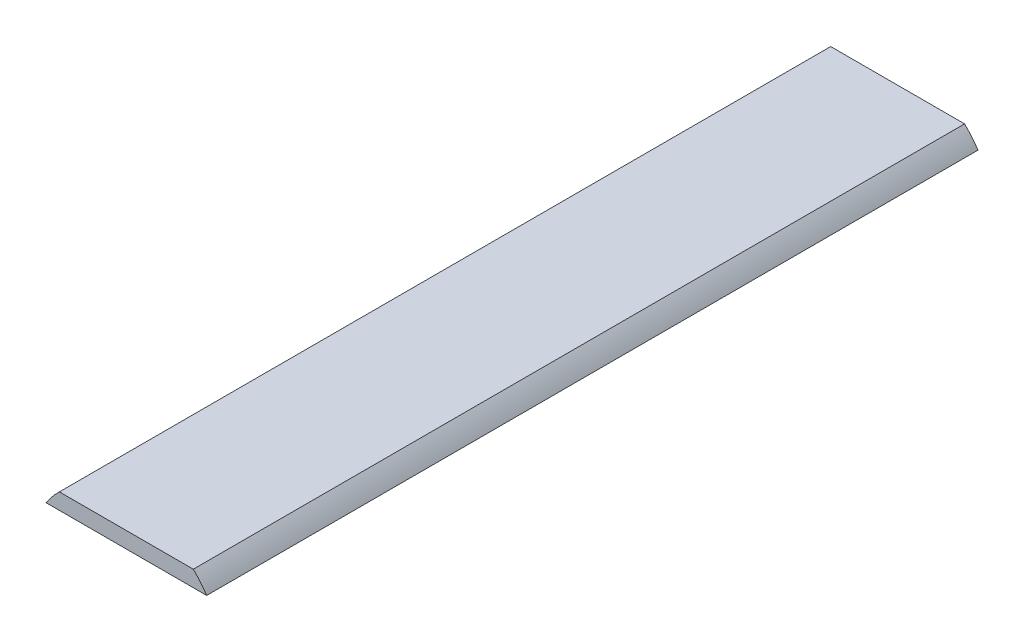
SolidWorks part; units mm, degrees
ref_plane "Front Plane" through (0, 0, 0) normal (0, 0, 1) x (1, 0, 0)
ref_plane "Top Plane" through (0, 0, 0) normal (0, 1, 0) x (1, 0, 0)
ref_plane "Right Plane" through (0, 0, 0) normal (1, 0, 0) x (0, 0, -1)
sketch "Sketch1" plane through (0, 0, 0) normal (0, 0, 1) x (1, 0, 0)
  circle A0 centre (0, 0) radius 19.05
  dimension "D1" = 38.1
extrude "Extrude1" add sketch "Sketch1" along normal blind 152.4
sketch "Sketch2" plane through (0, 0, 152.4) normal (0, 0, 1) x (1, 0, 0)
  line L0 (-13.2313, 13.7053) -> (13.2313, 13.7053)
  line L1 (-15.875, 10.5303) -> (15.875, 10.5303)
  circle A0 centre (0, 0) radius 19.05 construction
  arc A1 (-15.875, 10.5303) -> (15.875, 10.5303) centre (0, 0) ccw
  arc A2 (-13.2313, 13.7053) -> (13.2313, 13.7053) centre (0, 0) cw
  dimension "D1" = 3.175
  dimension "D2" = 31.75
extrude "Cut-Extrude1" cut sketch "Sketch2" against normal through all
sketch "Sketch3" plane through (0, 0, 0) normal (0, 0, -1) x (-1, 0, 0)
  line L2 (-15.875, 10.5303) -> (15.875, 10.5303)
  line L3 (13.2313, 13.7053) -> (-13.2313, 13.7053)
  line L4 (-15.875, 10.5303) -> (15.875, 10.5303)
  line L5 (13.2313, 13.7053) -> (-13.2313, 13.7053)
  arc A2 (-13.2313, 13.7053) -> (-15.875, 10.5303) centre (0, 0) ccw
  arc A3 (15.875, 10.5303) -> (13.2313, 13.7053) centre (0, 0) ccw
  arc A4 (-13.2313, 13.7053) -> (-15.875, 10.5303) centre (0, 0) ccw
  arc A5 (15.875, 10.5303) -> (13.2313, 13.7053) centre (0, 0) ccw
  dimension "D1" = 0
